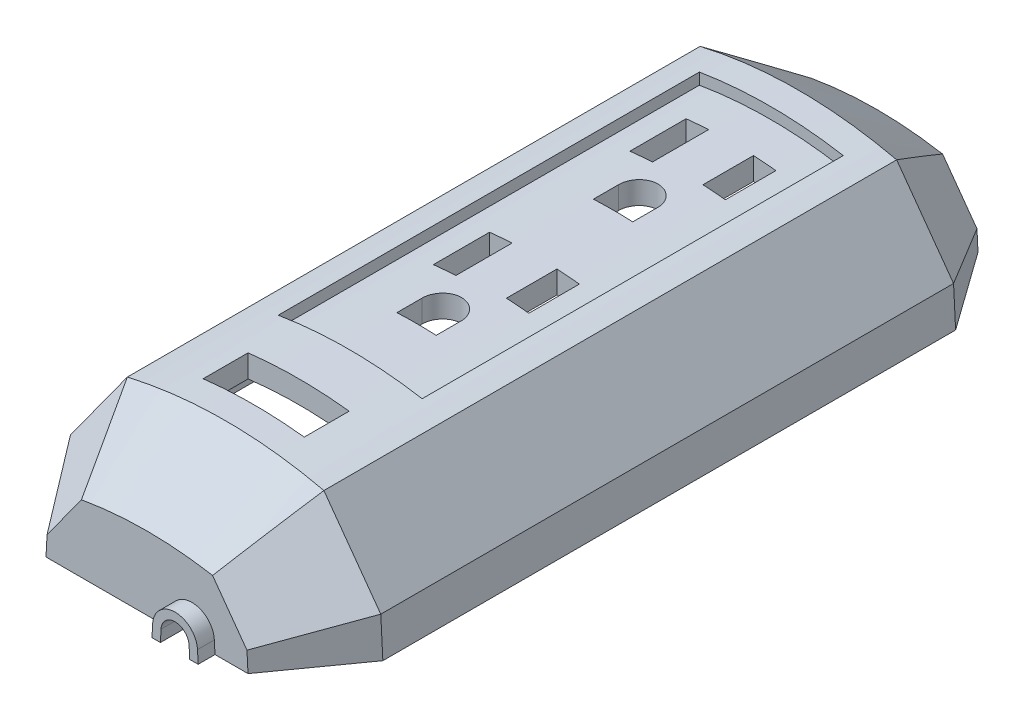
SolidWorks part; units mm, degrees
ref_plane "Front Plane" through (0, 0, 0) normal (0, 0, 1) x (1, 0, 0)
ref_plane "Top Plane" through (0, 0, 0) normal (0, 1, 0) x (1, 0, 0)
ref_plane "Right Plane" through (0, 0, 0) normal (1, 0, 0) x (0, 0, -1)
sketch "Sketch1" plane through (0, 0, 0) normal (0, 0, 1) x (1, 0, 0)
  line L0 (17.5, 21) -> (27.6331, 7)
  line L1 (-17.5, 21) -> (17.5, 21) construction
  line L2 (-27.6331, 7) -> (-28, 0)
  line L3 (-28, 0) -> (28, 0)
  line L4 (27.6331, 7) -> (28, 0)
  line L5 (-27.6331, 7) -> (-17.5, 21)
  line L6 (0, 0) -> (0, 21) construction
  arc A0 (-17.5, 21) -> (17.5, 21) centre (0, -53.985) cw
  dimension "D6" = 77
  dimension "D1" = 56
  dimension "D2" = 35
  dimension "D3" = 21
  dimension "D4" = 7
  dimension "D5" = 3
extrude "Extrude1" add sketch "Sketch1" along normal blind 130
chamfer "Chamfer1" distance 14 distance2 10 5 edges at (27.8166, 3.5, 130) (22.5666, 14, 130) (0, 23.015, 130) (-22.5666, 14, 130) (-27.8166, 3.5, 130)
chamfer "Chamfer2" distance 10 distance2 14 5 edges at (-27.8166, 3.5, 0) (-22.5666, 14, 0) (0, 23.015, 0) (22.5666, 14, 0) (27.8166, 3.5, 0)
sketch "Sketch2" plane through (5.7452, -1.8948, 130) normal (0, 0, 1) x (1, 0, 0)
  line L1 (-23.7315, 1.8948) -> (12.2411, 1.8948) construction
  line L2 (-1.8555, 1.8948) -> (6.3651, 1.8948)
  line L3 (-1.8555, 1.8948) -> (-1.7397, 4.1042)
  line L4 (6.3651, 1.8948) -> (6.2493, 4.1042)
  line L5 (2.2548, 1.8948) -> (2.2548, 3.8948) construction
  arc A0 (6.2493, 4.1042) -> (-1.7397, 4.1042) centre (2.2548, 3.8948) ccw
  circle A1 centre (2.2548, 3.8948) radius 2 construction
  dimension "D1" = 4
  dimension "D3" = 6
  dimension "D5" = 4
  dimension "D2" = 3
  dimension "D4" = 8
extrude "Extrude2" add sketch "Sketch2" along normal blind 3
ref_plane "Plane1" through (0, 30, 0) normal (0, 1, 0) x (1, 0, 0)
sketch "Sketch3" plane through (3.4925, 30, 107.5782) normal (0, 1, 0) x (1, 0, 0)
  line L0 (-31.1257, -8.4218) -> (-31.1257, 93.5782) construction
  line L1 (9.5075, 88.5782) -> (-16.1257, 88.5782)
  line L2 (9.5075, 88.5782) -> (9.5075, 13.5782)
  line L3 (9.5075, 13.5782) -> (-16.1257, 13.5782)
  line L4 (-16.1257, 88.5782) -> (-16.1257, 13.5782)
  line L6 (24.5075, -8.4218) -> (24.5075, 93.5782) construction
  line L11 (-20.9925, 93.5782) -> (-31.1257, 93.5782) construction
  dimension "D1" = 75
  dimension "D2" = 15
  dimension "D3" = 15
  dimension "D4" = 80
extrude "Cut-Extrude1" cut sketch "Sketch3" against normal offset from surface (10.1203 mm away) 2
sketch "Sketch4" plane through (-3.0826, 30, 40.4689) normal (0, 1, 0) x (-1, 0, 0)
  line L1 (14.4174, -26.4689) -> (24.5505, -26.4689) construction
  line L3 (0.9174, -14.4689) -> (-7.0826, -14.4689) construction
  line L4 (-3.0826, 2.0311) -> (-3.0826, -14.4689) construction
  line L6 (-3.0826, 9.5311) -> (-3.0826, -90.4689) construction
  line L9 (-7.0826, -14.4689) -> (-7.0826, -5.4689)
  line L10 (-11.0826, -14.4689) -> (-7.0826, -14.4689)
  line L11 (-11.0826, -5.4689) -> (-11.0826, -14.4689)
  line L12 (-7.0826, -5.4689) -> (-11.0826, -5.4689)
  line L18 (4.9174, -14.4689) -> (4.9174, -4.4689)
  line L19 (0.9174, -14.4689) -> (4.9174, -14.4689)
  line L20 (0.9174, -4.4689) -> (0.9174, -14.4689)
  line L21 (4.9174, -4.4689) -> (0.9174, -4.4689)
  line L25 (-6.5826, 6.5311) -> (-6.5826, 2.0311)
  line L26 (0.4174, 6.5311) -> (-6.5826, 6.5311)
  line L27 (0.4174, 2.0311) -> (0.4174, 6.5311)
  arc A2 (-6.5826, 2.0311) -> (0.4174, 2.0311) centre (-3.0826, 2.0311) ccw
  dimension "D1" = 21
  dimension "D2" = 4
  dimension "D3" = 8
  dimension "D4" = 10
  dimension "D5" = 9
  dimension "D6" = 7
  dimension "D7" = 4.5
  dimension "D8" = 12
extrude "Cut-Extrude2" cut sketch "Sketch4" against normal offset from surface (13.0978 mm away) 6
pattern_linear "LPattern1" count 2 spacing 35 along (0, 0, 1) of "Cut-Extrude2"
sketch "Sketch5" plane through (0.7926, 30, 213.5131) normal (0, 1, 0) x (1, 0, 0)
  line L0 (-0.7926, 102.5131) -> (-0.7926, 110.5131) construction
  line L1 (-9.7926, 102.5131) -> (8.2074, 102.5131)
  line L2 (-9.7926, 102.5131) -> (-9.7926, 110.5131)
  line L3 (-9.7926, 110.5131) -> (8.2074, 110.5131)
  line L4 (8.2074, 102.5131) -> (8.2074, 110.5131)
  line L5 (-28.4257, 97.5131) -> (-18.2926, 97.5131) construction
  line L8 (-0.7926, 163.5131) -> (-0.7926, 263.5131) construction
  dimension "D1" = 5
  dimension "D2" = 8
  dimension "D3" = 18
extrude "Cut-Extrude3" cut sketch "Sketch5" against normal offset from surface (11.5419 mm away) 4
shell "Shell1" thickness 1.5
